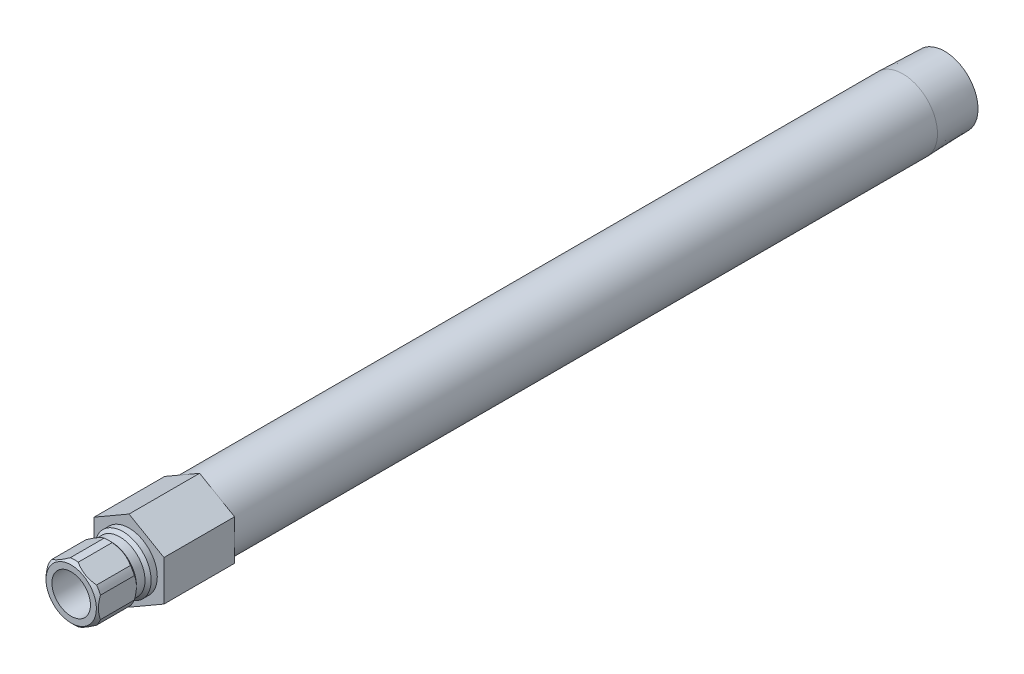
SolidWorks part; units mm, degrees
ref_plane "Front Plane" through (0, 0, 0) normal (0, 0, 1) x (1, 0, 0)
ref_plane "Top Plane" through (0, 0, 0) normal (0, 1, 0) x (1, 0, 0)
ref_plane "Right Plane" through (0, 0, 0) normal (1, 0, 0) x (0, 0, -1)
sketch "Sketch1" plane through (0, 0, 0) normal (1, 0, 0) x (0, 0, -1)
  line L0 (0, 0) -> (-17.4752, 0) construction
  line L1 (-14.3002, 4.7625) -> (-14.3002, 6.223)
  line L2 (-4.3942, 6.223) -> (-4.3942, 0) construction
  line L3 (-13.5382, 6.985) -> (-5.1562, 6.985)
  line L5 (-4.3942, 6.223) -> (-2.2708, 6.223)
  line L6 (-1.5088, 6.985) -> (3.175, 6.985)
  line L7 (3.175, 6.985) -> (3.175, 8.5725)
  line L8 (-4.3942, 6.223) -> (-5.1562, 6.985)
  line L9 (-2.2708, 6.223) -> (-1.5088, 6.985)
  line L10 (-14.3002, 6.223) -> (-13.5382, 6.985)
  line L11 (-14.3002, 4.7625) -> (17.4498, 4.7625)
  line L12 (3.175, 8.5725) -> (191.262, 8.5725)
  line L13 (191.262, 8.5725) -> (201.5998, 8.2494)
  line L14 (201.5998, 8.2494) -> (201.5998, 6.2611)
  line L15 (0, 8.5725) -> (0, 0) construction
  line L16 (17.4498, 4.7625) -> (17.4498, 0) construction
  line L17 (17.4498, 0) -> (0, 0) construction
  line L18 (17.4498, 4.7625) -> (17.4498, 6.2611)
  line L19 (17.4498, 6.2611) -> (201.5998, 6.2611)
  dimension "D1" = 17.4752
  dimension "D2" = 2.1234
  dimension "D3" = 0.762
  dimension "D4" = 45
  dimension "D5" = 9.906
  dimension "D6" = 45
  dimension "D7" = 1.79
  dimension "D8" = 10.3378
  dimension "D9" = 215.9
  dimension "D10" = 3.175
  dimension "D11" = 9.525
  dimension "D12" = 17.145
  dimension "D13" = 31.75
  dimension "D14" = 13.97
  dimension "D15" = 12.5222
  dimension "D16" = 17.4498
revolve "Revolve1" add sketch "Sketch1" angle 360 about L0
sketch "Sketch2" plane through (0, 0, 0) normal (0, 0, 1) x (1, 0, 0)
  line L1 (-8.636, 4.986) -> (-8.636, -4.986)
  line L2 (-8.636, -4.986) -> (0, -9.972)
  line L3 (0, -9.972) -> (8.636, -4.986)
  line L4 (8.636, -4.986) -> (8.636, 4.986)
  line L5 (8.636, 4.986) -> (0, 9.972)
  line L6 (0, 9.972) -> (-8.636, 4.986)
  circle A0 centre (0, 0) radius 8.636 construction
  circle A1 centre (0, 0) radius 4.7625 construction
  circle A2 centre (0, 0) radius 4.7625
  dimension "D1" = 17.272
extrude "Boss-Extrude1" add sketch "Sketch2" against normal up to vertex (17.4498 mm away)
sketch "Sketch3" plane through (0, 0, 0) normal (0, 0, 1) x (1, 0, 0)
  line L1 (6.477, -3.7395) -> (6.477, 3.7395)
  line L2 (6.477, 3.7395) -> (0, 7.479)
  line L3 (0, 7.479) -> (-6.477, 3.7395)
  line L4 (-6.477, 3.7395) -> (-6.477, -3.7395)
  line L5 (-6.477, -3.7395) -> (0, -7.479)
  line L6 (0, -7.479) -> (6.477, -3.7395)
  circle A0 centre (0, 0) radius 6.477 construction
  dimension "D1" = 12.954
extrude "Cut-Extrude1" cut sketch "Sketch3" along normal through all from vertex at 4.3942 flip side to cut
